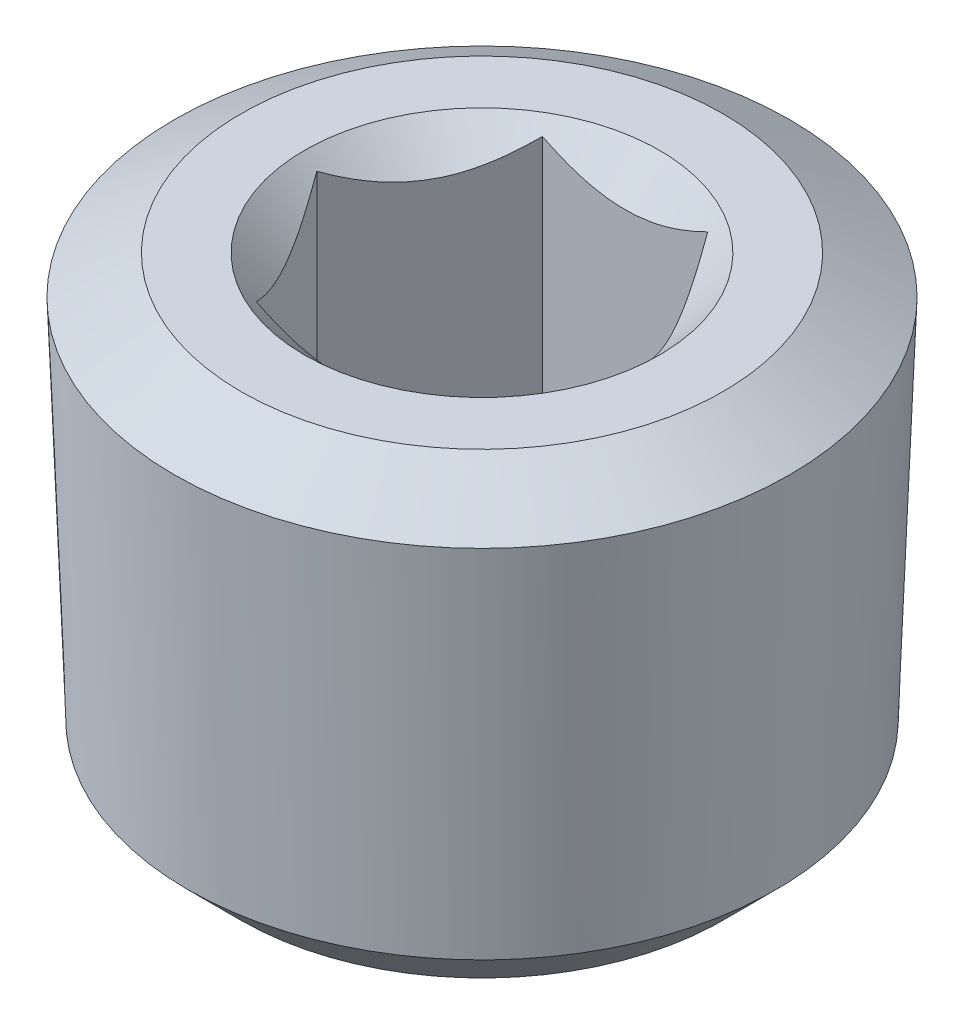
SolidWorks part; units mm, degrees
ref_plane "Front Plane" through (0, 0, 0) normal (0, 0, 1) x (1, 0, 0)
ref_plane "Top Plane" through (0, 0, 0) normal (0, 1, 0) x (1, 0, 0)
ref_plane "Right Plane" through (0, 0, 0) normal (1, 0, 0) x (0, 0, -1)
sketch "Sketch2" plane through (0, 0, 0) normal (0, 0, 1) x (1, 0, 0)
  line L0 (0, 10.7443) -> (0, -17.0657) construction
  line L1 (0, 0) -> (-5.3446, 0)
  line L2 (-6.8268, -0.8558) -> (-6.5308, -8.9738)
  line L3 (-5.3446, -10.16) -> (0, -10.16)
  line L4 (0, -10.16) -> (0, 0)
  line L6 (-5.3446, -10.16) -> (-6.5308, -8.9738)
  line L7 (-5.3446, 0) -> (-6.8268, -0.8558)
  point P4 (-6.858, 0)
  point P6 (-6.4876, -10.16)
  dimension "D1" = 10.16
  dimension "D2" = 2.088
  dimension "D3" = 13.716
  dimension "D4" = 30
  dimension "D5" = 1.143
  dimension "D6" = 45
revolve "Revolve1" add sketch "Sketch2" angle 360 about L0
sketch "Sketch3" plane through (0, 0, 0) normal (0, 0, 1) x (1, 0, 0)
  line L0 (0, 2.9342) -> (0, -8.1202) construction
  line L1 (0, 0) -> (-3.937, 0)
  line L2 (5.3446, 0) -> (-5.3446, 0) construction
  line L3 (-3.175, -0.762) -> (-3.175, -5.588)
  line L4 (-3.175, -5.588) -> (0, -7.4957)
  line L5 (0, -7.4957) -> (0, 0)
  line L6 (-3.175, -0.762) -> (-3.937, 0)
  line L7 (-5.3446, -10.16) -> (5.3446, -10.16) construction
  dimension "D1" = 5.588
  dimension "D2" = 59
  dimension "D3" = 6.35
  dimension "D4" = 0.762
  dimension "D5" = 45
revolve "Cut-Revolve1" cut sketch "Sketch3" angle 360 about L0
sketch "Sketch4" plane through (0, 0, 0) normal (0, 1, 0) x (1, 0, 0)
  line L1 (-1.8331, -3.175) -> (1.8331, -3.175)
  line L2 (1.8331, -3.175) -> (3.6662, 0)
  line L3 (3.6662, 0) -> (1.8331, 3.175)
  line L4 (1.8331, 3.175) -> (-1.8331, 3.175)
  line L5 (-1.8331, 3.175) -> (-3.6662, 0)
  line L6 (-3.6662, 0) -> (-1.8331, -3.175)
  circle A0 centre (0, 0) radius 3.175 construction
  circle A1 centre (0, 0) radius 3.175 construction
extrude "Cut-Extrude1" cut sketch "Sketch4" against normal up to vertex (5.2929 mm away)
